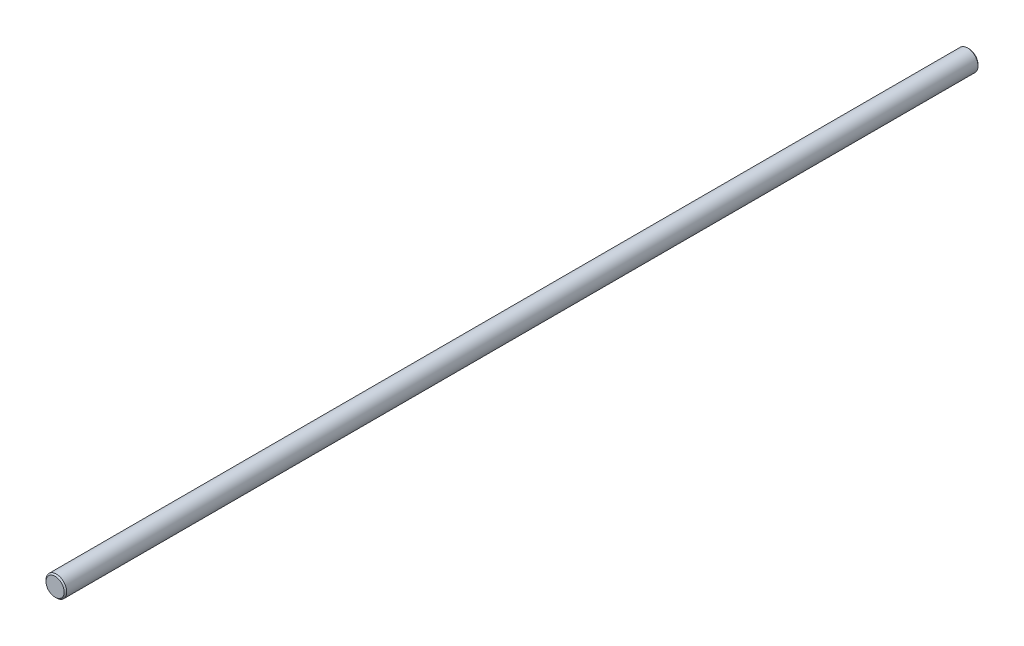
SolidWorks part; units mm, degrees
ref_plane "Спереди" through (0, 0, 0) normal (0, 0, 1) x (1, 0, 0)
ref_plane "Сверху" through (0, 0, 0) normal (0, 1, 0) x (1, 0, 0)
ref_plane "Справа" through (0, 0, 0) normal (1, 0, 0) x (0, 0, -1)
sketch "Эскиз1" plane through (0, 0, 0) normal (0, 1, 0) x (1, 0, 0)
  line L0 (3.5, 176) -> (0, 176)
  line L1 (0, 176) -> (0, -176)
  line L2 (0, -176) -> (3.5, -176)
  line L3 (3.5, -176) -> (4, -175.5)
  line L4 (4, -175.5) -> (4, 175.5)
  line L5 (4, 175.5) -> (3.5, 176)
  line L6 (0, 176) -> (0, -176) construction
  point P6 (0, 0)
  dimension "D1" = 352
  dimension "D2" = 4
  dimension "D3" = 0.5
  dimension "D4" = 0.5
revolve "Повернуть1" add sketch "Эскиз1" angle 360 about L6
